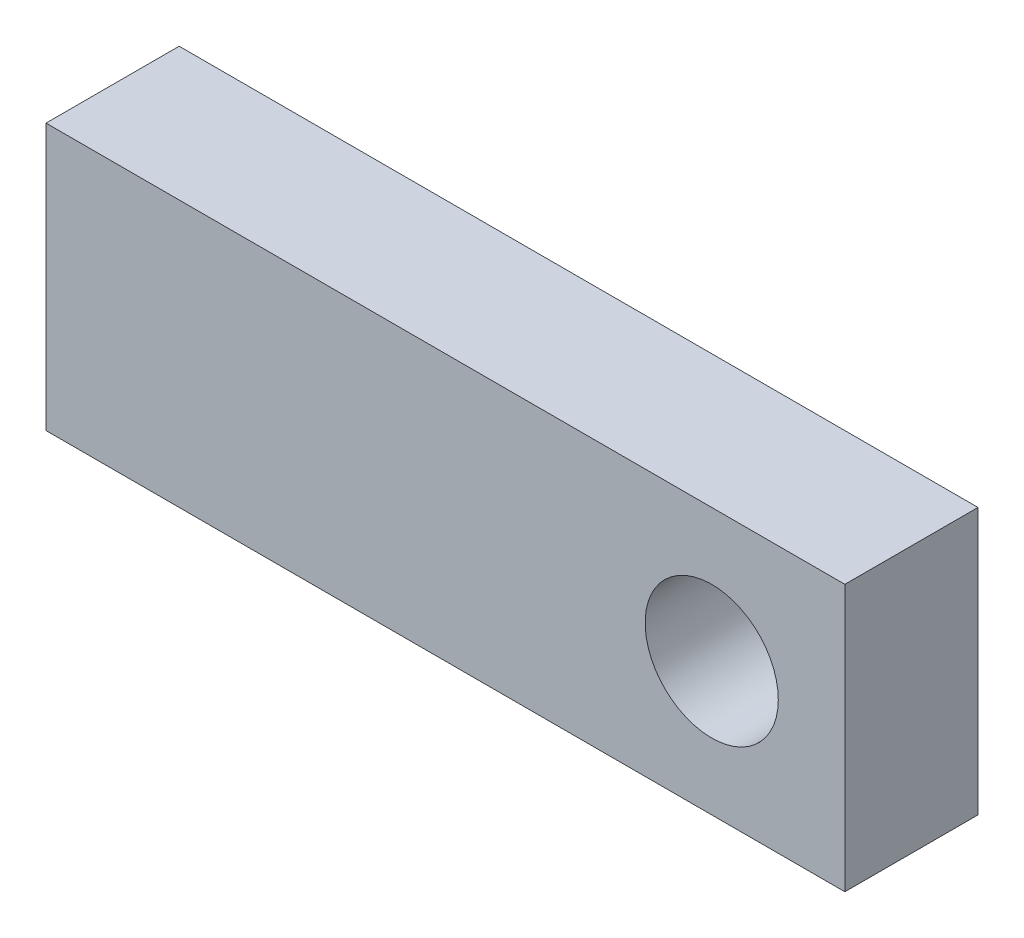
SolidWorks part; units mm, degrees
ref_plane "Front Plane" through (0, 0, 0) normal (0, 0, 1) x (1, 0, 0)
ref_plane "Top Plane" through (0, 0, 0) normal (0, 1, 0) x (1, 0, 0)
ref_plane "Right Plane" through (0, 0, 0) normal (1, 0, 0) x (0, 0, -1)
sketch "Sketch1" plane through (0, 0, 0) normal (0, 0, 1) x (1, 0, 0)
  line L1 (-27.2343, 17.1906) -> (48.9657, 17.1906)
  line L2 (-27.2343, 17.1906) -> (-27.2343, -8.2094)
  line L3 (-27.2343, -8.2094) -> (48.9657, -8.2094)
  line L4 (48.9657, 17.1906) -> (48.9657, -8.2094)
  circle A0 centre (36.2657, 4.4906) radius 6.35
  dimension "D3" = 12.7
  dimension "D4" = 12.7
  dimension "D5" = 12.7
  dimension "D1" = 25.4
  dimension "D2" = 76.2
extrude "Extrude1" add sketch "Sketch1" along normal blind 12.7
